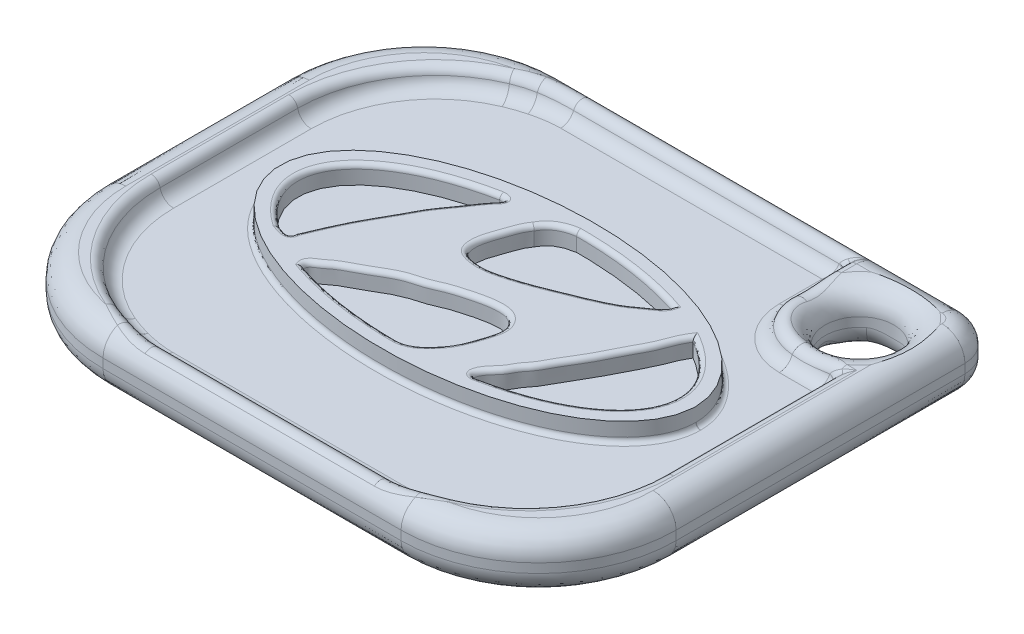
SolidWorks part; units mm, degrees
ref_plane "Ön Düzlem" through (0, 0, 0) normal (0, 0, 1) x (1, 0, 0)
ref_plane "Üst Düzlem" through (0, 0, 0) normal (0, 1, 0) x (1, 0, 0)
ref_plane "Sağ Düzlem" through (0, 0, 0) normal (1, 0, 0) x (0, 0, -1)
sketch "Çizim1" plane through (0, 0, 0) normal (0, 1, 0) x (1, 0, 0)
  line L1 (-41.6667, 37.8333) -> (53.3333, 37.8333)
  line L2 (-71.6667, 7.8333) -> (-71.6667, -32.1667)
  line L3 (-41.6667, -62.1667) -> (23.3333, -62.1667)
  line L4 (53.3333, 37.8333) -> (53.3333, -32.1667)
  arc A0 (23.3333, -62.1667) -> (53.3333, -32.1667) centre (23.3333, -32.1667) ccw
  arc A1 (-71.6667, -32.1667) -> (-41.6667, -62.1667) centre (-41.6667, -32.1667) ccw
  arc A2 (-41.6667, 37.8333) -> (-71.6667, 7.8333) centre (-41.6667, 7.8333) ccw
  circle A3 centre (38.3333, 22.8333) radius 7.5
  point P8 (-71.6667, -62.1667)
  point P11 (-71.6667, 37.8333)
  dimension "D3" = 30
  dimension "D4" = 15
  dimension "D1" = 100
  dimension "D2" = 125
  dimension "D5" = 15
extrude "Yükseklik-Ekstrüzyon1" add sketch "Çizim1" along normal blind 12
sketch "Çizim2" plane through (0, 12, 0) normal (0, 1, 0) x (1, 0, 0)
  line L0 (53.3333, 37.8333) -> (-41.6667, 37.8333) construction
  line L1 (-34.1667, 32.8333) -> (25.8333, 32.8333)
  line L2 (-64.1667, 2.8333) -> (-64.1667, -27.1667)
  line L3 (-34.1667, -57.1667) -> (15.8333, -57.1667)
  line L4 (45.8333, 10.8333) -> (45.8333, -27.1667)
  line L5 (-71.6667, 7.8333) -> (-71.6667, -32.1667) construction
  line L8 (25.8333, 32.8333) -> (25.8333, 20.8333)
  line L9 (35.8333, 10.8333) -> (45.8333, 10.8333)
  arc A0 (15.8333, -57.1667) -> (45.8333, -27.1667) centre (15.8333, -27.1667) ccw
  arc A1 (-64.1667, -27.1667) -> (-34.1667, -57.1667) centre (-34.1667, -27.1667) ccw
  arc A2 (-34.1667, 32.8333) -> (-64.1667, 2.8333) centre (-34.1667, 2.8333) ccw
  arc A3 (25.8333, 20.8333) -> (35.8333, 10.8333) centre (35.8333, 20.8333) ccw
  point P8 (-64.1667, -57.1667)
  point P11 (-64.1667, 32.8333)
  dimension "D3" = 30
  dimension "D8" = 10
  dimension "D1" = 90
  dimension "D2" = 110
  dimension "D4" = 5
  dimension "D5" = 7.5
extrude "Kes-Ekstrüzyon1" cut sketch "Çizim2" against normal blind 4
sketch "Çizim3" plane through (0, 0, 0) normal (0, -1, 0) x (1, 0, 0)
  line L0 (-41.6667, 62.1667) -> (23.3333, 62.1667) construction
  line L1 (-34.1667, 57.1667) -> (15.8333, 57.1667)
  line L2 (-64.1667, 27.1667) -> (-64.1667, -2.8333)
  line L3 (-34.1667, -32.8333) -> (25.8333, -32.8333)
  line L4 (45.8333, 27.1667) -> (45.8333, -10.8333)
  line L6 (-71.6667, -7.8333) -> (-71.6667, 32.1667) construction
  line L11 (25.8333, -32.8333) -> (25.8333, -20.8333)
  line L12 (35.8333, -10.8333) -> (45.8333, -10.8333)
  arc A0 (25.8333, -20.8333) -> (35.8333, -10.8333) centre (35.8333, -20.8333) cw
  arc A1 (-64.1667, -2.8333) -> (-34.1667, -32.8333) centre (-34.1667, -2.8333) ccw
  arc A2 (-34.1667, 57.1667) -> (-64.1667, 27.1667) centre (-34.1667, 27.1667) ccw
  arc A3 (15.8333, 57.1667) -> (45.8333, 27.1667) centre (15.8333, 27.1667) cw
  point P14 (25.8333, -10.8333)
  point P15 (-64.1667, -32.8333)
  point P18 (-64.1667, 57.1667)
  dimension "D7" = 10
  dimension "D1" = 30
  dimension "D2" = 90
  dimension "D3" = 5
  dimension "D4" = 7.5
  dimension "D5" = 22
  dimension "D6" = 20
extrude "Kes-Ekstrüzyon2" cut sketch "Çizim3" against normal blind 4
fillet "Radyus11" radius 5 15 edges at (5.8333, 12, -37.8333) (53.3333, 12, -2.8333) (44.5465, 12, 53.3799) (-9.1667, 12, 62.1667) (-62.8799, 12, 53.3799) (-71.6667, 12, 12.1667) (5.8333, 0, -37.8333) (53.3333, 0, -2.8333) (44.5465, 0, 53.3799) (-9.1667, 0, 62.1667) (-62.8799, 0, 53.3799) (-71.6667, 0, 12.1667) (38.3333, 12, -15.3333) (-62.8799, 12, -29.0465) (-62.8799, 0, -29.0465)
fillet "Radyus12" radius 5 1 edges at (38.3333, 0, -15.3333)
fillet "Radyus13" radius 3 10 edges at (-64.1667, 4, 12.1667) (-55.3799, 4, 48.3799) (-9.1667, 4, 57.1667) (37.0465, 4, 48.3799) (45.8333, 4, 8.1667) (40.8333, 4, -10.8333) (28.7623, 4, -13.7623) (25.8333, 4, -26.8333) (-4.1667, 4, -32.8333) (-55.3799, 4, -24.0465)
fillet "Radyus14" radius 3 2 edges at (25.8333, 0, -27.8333) (38.8331, 0.024, -10.8333)
fillet "Radyus15" radius 3 4 edges at (27.2654, 0.2614, -32.8333) (45.8333, 0.3856, -12.0869) (24.5654, 3.4495, -31.5654) (44.5447, 3.464, -9.5447)
fillet "Radyus18" radius 2 7 edges at (-55.3799, 12, -24.0465) (-64.1667, 12, 12.1667) (-9.1667, 12, 57.1667) (37.0465, 12, 48.3799) (-55.3799, 12, 48.3799) (-4.1667, 12, -32.8333) (45.8333, 12, 8.1667)
fillet "Radyus19" radius 7 3 edges at (51.8689, 1.4645, -36.3689) (51.8689, 10.5355, -36.3689) (53.3333, 6, -37.8333)
fillet "Radyus20" radius 3 10 edges at (40.8333, 8, -10.8333) (25.8333, 8, -26.8333) (-4.1667, 8, -32.8333) (45.8333, 8, 8.1667) (37.0465, 8, 48.3799) (-9.1667, 8, 57.1667) (-55.3799, 8, 48.3799) (-64.1667, 8, 12.1667) (28.7623, 8, -13.7623) (-55.3799, 8, -24.0465)
fillet "Radyus23" radius 2 6 edges at (44.8333, 12, -10.8333) (38.8333, 11.976, -10.8333) (25.8333, 12, -21.8333) (25.8333, 11.6709, -34.6174) (25.8333, 12, -27.8333)
fillet "Radyus24" radius 2 5 edges at (24.5399, 8.5327, -31.8614) (44.8317, 8.6762, -9.7307) (26.2034, 11.1204, -34.163) (46.5684, 11.5492, -11.4674)
sketch "Çizim4" plane through (0, 8, 0) normal (0, 1, 0) x (1, 0, 0)
  line L0 (237.0641, 420.5158) -> (1403.0641, 420.5158) construction
  line L1 (37.1324, -11.6609) -> (37.1324, -11.5883)
  ellipse E0 centre (-8.3166, -11.5244) end of major axis (37.1324, -11.6609) minor radius 23.4449 (37.1324, -11.5883) -> (37.1324, -11.6609) ccw
  ellipse E1 centre (-8.3166, -11.5244) end of major axis (33.1931, -11.5492) minor radius 19.9445 (-24.2147, 6.9065) -> (-42.6027, -22.7514) ccw
  ellipse E2 centre (-8.3166, -11.5244) end of major axis (33.1931, -11.5492) minor radius 19.9445 (15.5665, 4.7771) -> (-8.943, 8.418) ccw
  ellipse E3 centre (-8.3166, -11.5244) end of major axis (33.1931, -11.5492) minor radius 19.9445 (7.8016, -29.9113) -> (23.6851, 1.1635) ccw
  ellipse E4 centre (-8.3166, -11.5244) end of major axis (33.1931, -11.5492) minor radius 19.9445 (-32.582, -27.6951) -> (-8.3285, -31.4689) ccw
  spline S0 degree 2 poles (-24.2147, 6.9065) (-22.0914, 6.9863) (-23.4938, 5.6192) knots 0 0 0 1 1 1
  spline S1 degree 3 poles (-39.4135, -22.278) (-39.3967, -24.2814) (-41.6875, -22.9641) (-42.6027, -22.7514) knots 0 0 0 0 1 1 1 1
  spline S2 degree 3 poles (-39.4135, -22.278) (-38.527, -20.1459) (-37.0384, -16.5357) (-34.4558, -11.4734) (-31.977, -7.3363) (-29.9995, -3.2408) (-26.873, 0.7679) (-25.034, 3.8804) (-23.4938, 5.6192) knots 0 0 0 0 0.21499 0.363266 0.528425 0.664056 0.784906 1 1 1 1
  spline S3 degree 3 poles (8.3615, -29.7959) (5.9136, -30.5169) (6.8783, -27.6683) (9.1927, -25.8539) (10.2338, -23.3817) (12.0646, -21.4051) (13.3146, -18.7512) (15.2502, -15.6965) (17.2282, -12.3021) (18.9768, -8.4479) (21.584, -4.1408) (22.4698, -0.6436) (23.6851, 1.1635) knots 0 0 0 0 0.092484 0.178392 0.248894 0.301291 0.3953 0.483676 0.594347 0.712681 0.825972 1 1 1 1
  spline S4 degree 3 poles (-32.582, -27.6951) (-32.9239, -26.5515) (-31.0829, -25.7953) (-29.1664, -24.0275) (-26.49, -22.7189) (-23.1023, -20.7895) (-19.7031, -18.7081) (-15.816, -17.9175) (-12.8433, -16.387) (-9.7531, -15.4938) (-6.7372, -14.6994) (-3.7498, -14.1644) (-0.5516, -14.4277) (1.7843, -17.2146) (0.8787, -20.7664) (-0.1352, -23.698) (-1.1681, -26.1992) (-3.4622, -29.2503) (-5.754, -31.4312) (-8.3285, -31.4689) knots 0 0 0 0 0.050965 0.084335 0.140781 0.203502 0.290121 0.346337 0.409143 0.463934 0.514396 0.572189 0.623568 0.674194 0.739109 0.800449 0.840513 0.87919 1 1 1 1
  spline S6 degree 3 poles (-8.943, 8.418) (-11.2338, 8.1373) (-13.562, 7.0542) (-14.6353, 4.8167) knots 0 0 0 0 1 1 1 1
  spline S7 degree 3 poles (-14.6353, 4.8167) (-15.4961, 3.7553) (-16.2831, 1.2895) (-17.4576, -1.8623) (-18.0829, -4.5438) (-17.6217, -7.2555) (-14.8548, -8.2164) (-11.7782, -8.3496) (-7.8421, -7.3351) (-3.9295, -6.0744) (1.2514, -3.9472) (6.0313, -2.1085) (10.5124, 0.2374) (13.1483, 2.4149) (15.2547, 3.5865) (15.5665, 4.7771) knots 0.100166 0.100166 0.100166 0.100166 0.176797 0.236777 0.286355 0.330322 0.370362 0.433024 0.50169 0.591406 0.660192 0.809872 0.874144 0.936714 1 1 1 1
extrude "Yükseklik-Ekstrüzyon2" add sketch "Çizim4" along normal blind 4 contours L1 E0 S7 S6 E2 S2 S1 E1 S0 E3 S3 E4 S4
fillet "Radyus25" radius 1 3 edges at (-21.0712, 12, 30.4982) (-53.7656, 8, 11.4243)
fillet "Radyus26" radius 1 3 edges at (3.9098, 12, -7.5296)
fillet "Radyus27" radius 1 2 edges at (32.0673, 12, 16.1564)
fillet "Radyus28" radius 1 4 edges at (-48.0996, 12, 5.8136)
fillet "Radyus29" radius 1 1 edges at (37.1324, 8, 11.6226)
